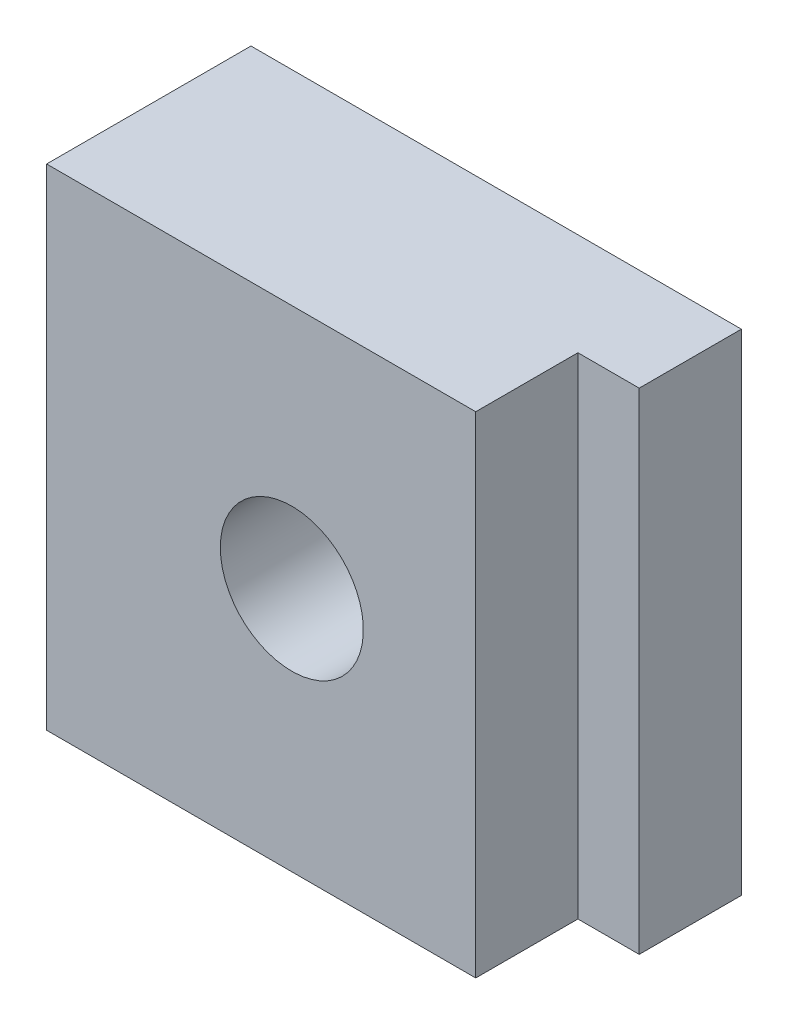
SolidWorks part; units mm, degrees
ref_plane "XY" through (0, 0, 0) normal (0, 0, 1) x (1, 0, 0)
ref_plane "XZ" through (0, 0, 0) normal (0, 1, 0) x (1, 0, 0)
ref_plane "YZ" through (0, 0, 0) normal (1, 0, 0) x (0, 0, -1)
sketch "Esquisse1" plane through (0, 0, 0) normal (0, 1, 0) x (1, 0, 0)
  line L0 (6, 2.5) -> (-6, 2.5)
  line L1 (-6, 2.5) -> (-6, -2.5)
  line L2 (-6, -2.5) -> (4.5, -2.5)
  line L3 (4.5, -2.5) -> (4.5, 0)
  line L4 (4.5, 0) -> (6, 0)
  line L5 (6, 2.5) -> (6, 0)
  dimension "D1" = 12
  dimension "D2" = 1.5
  dimension "D3" = 6
  dimension "D4" = 5
  dimension "D5" = 2.5
extrude "Bride" add sketch "Esquisse1" along normal mid plane 12
sketch "Esquisse2" plane through (0, 0, 0) normal (0, 0, 1) x (1, 0, 0)
  circle A0 centre (0, 0) radius 1.75
  dimension "D1" = 3.5
extrude "Passage vis" cut sketch "Esquisse2" against normal up to surface (2.5 mm away)
sketch "Esquisse3" plane through (0, 0, 0) normal (0, 0, 1) x (1, 0, 0)
  circle A0 centre (0, 0) radius 3
  dimension "D1" = 6
extrude "Lamage" cut sketch "Esquisse3" against normal up to surface (2.5 mm away)
